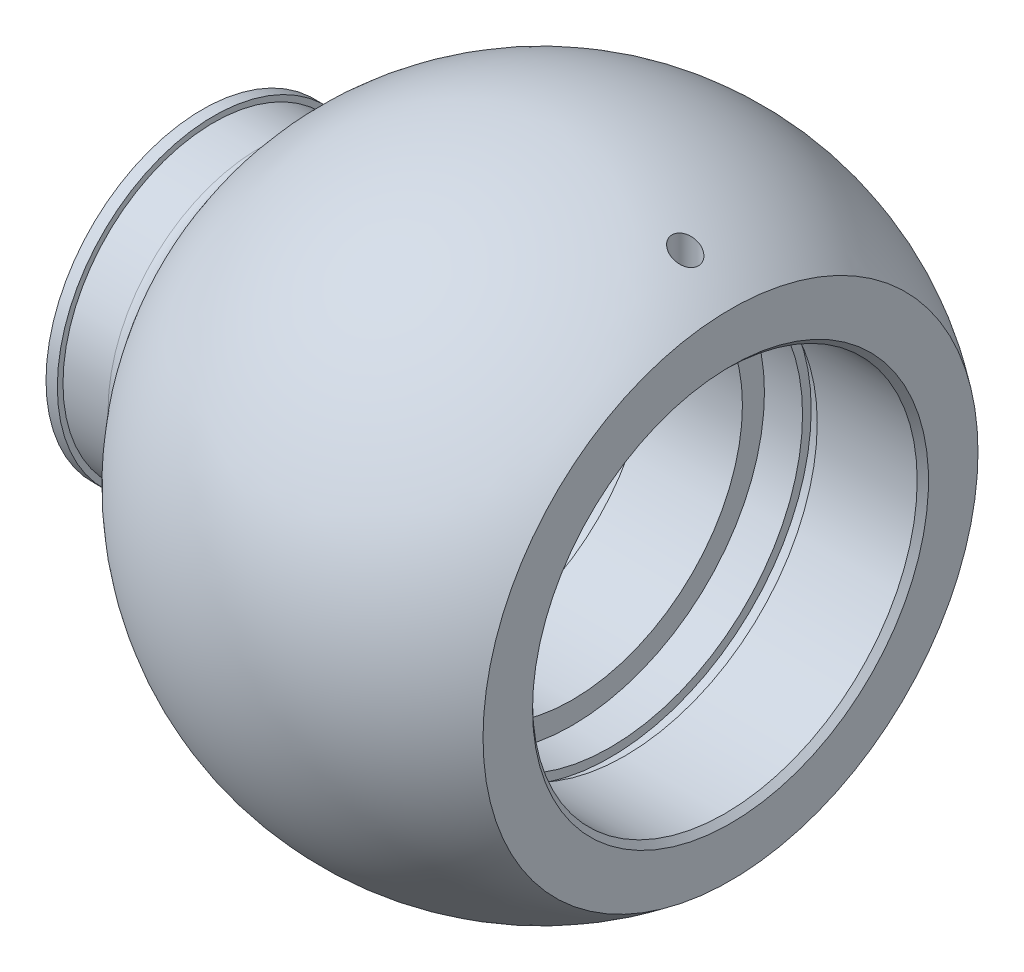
SolidWorks part; units mm, degrees
ref_plane "Plan de face" through (0, 0, 0) normal (0, 0, 1) x (1, 0, 0)
ref_plane "Plan de dessus" through (0, 0, 0) normal (0, 1, 0) x (1, 0, 0)
ref_plane "Plan de droite" through (0, 0, 0) normal (1, 0, 0) x (0, 0, -1)
sketch "Esquisse1" plane through (0, 0, 0) normal (0, 0, 1) x (1, 0, 0)
  line L0 (0, 41.5) -> (0, 27.75)
  line L1 (0, 27.75) -> (2, 27.75)
  line L2 (0, 41.5) -> (3, 41.5)
  line L3 (3, 41.5) -> (3, 40)
  line L4 (3, 40) -> (14.9583, 40)
  line L5 (2, 29) -> (7, 29)
  line L8 (2, 27.75) -> (2, 29)
  line L9 (7, 25) -> (7, 29)
  line L10 (7, 25) -> (12, 25)
  line L13 (12, 30) -> (12, 25)
  line L14 (23, 25) -> (68, 25)
  line L15 (23, 30) -> (23, 25)
  line L16 (12, 30) -> (23, 30)
  line L18 (68, 48) -> (68, 25)
  line L19 (68, 48) -> (73, 48)
  line L21 (73, 48) -> (73, 45.16)
  line L24 (98, 51) -> (98, 45.16)
  line L25 (73, 45.16) -> (98, 45.16)
  line L27 (98, 51) -> (108.1, 51)
  line L29 (112, 53.3) -> (112, 51)
  line L30 (108.1, 53.3) -> (108.1, 51)
  line L31 (108.1, 53.3) -> (112, 53.3)
  line L33 (112, 51) -> (138.5, 51)
  line L38 (140, 65.622) -> (140, 52.5)
  line L39 (138.5, 51) -> (140, 52.5)
  line L46 (-14.5013, 0) -> (173.9327, 0) construction
  arc A0 (140, 65.622) -> (19.2464, 42.4286) centre (90, 0) ccw
  arc A1 (14.9583, 40) -> (19.2464, 42.4286) centre (14.9583, 45) ccw
revolve "Révolution1" add sketch "Esquisse1" angle 360 about L46
sketch "Esquisse2" plane through (0, 0, 0) normal (0, 1, 0) x (1, 0, 0)
  line L0 (-6.2883, 0) -> (163.646, 0) construction
  line L1 (140, -65.622) -> (140, 65.622) construction
  circle A0 centre (128, 0) radius 3.5
  dimension "D1" = 7
  dimension "D2" = 12
extrude "Extrusion1" cut sketch "Esquisse2" along normal blind 97
sketch "Esquisse3" plane through (0, 0, 0) normal (0, 1, 0) x (1, 0, 0)
  line L0 (90, 82.5) -> (90, -82.5) construction
  line L1 (0, 0) -> (164.0658, 0) construction
  arc A0 (140, 65.622) -> (19.2464, 42.4286) centre (90, 0) ccw construction
  arc A1 (19.2464, -42.4286) -> (140, -65.622) centre (90, 0) ccw construction
  point P11 (90, 0)
